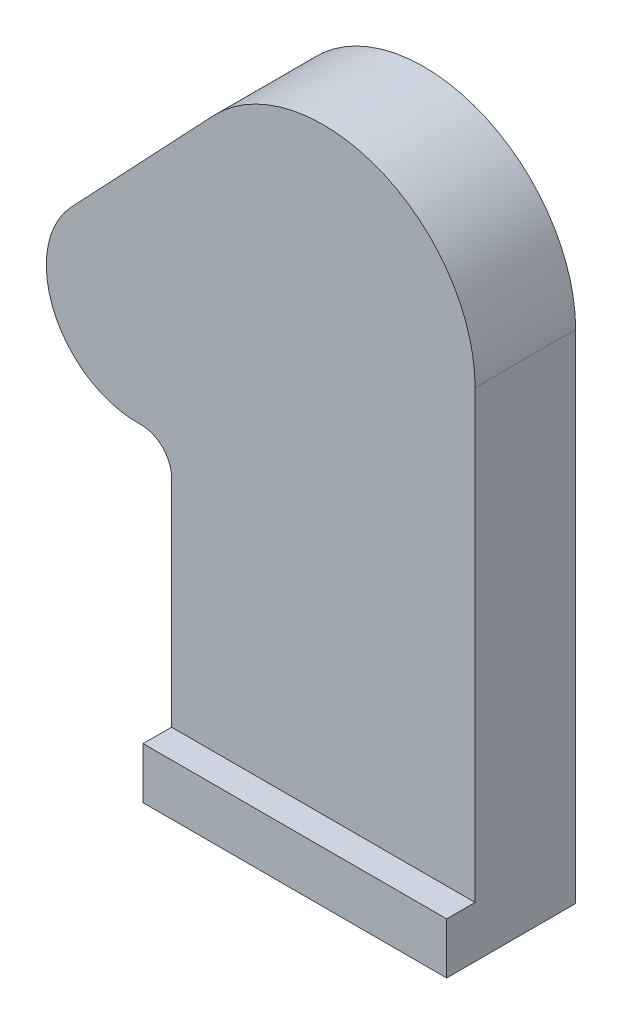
SolidWorks part; units mm, degrees
ref_plane "Plan de face" through (0, 0, 0) normal (0, 0, 1) x (1, 0, 0)
ref_plane "Plan de dessus" through (0, 0, 0) normal (0, 1, 0) x (1, 0, 0)
ref_plane "Plan de droite" through (0, 0, 0) normal (1, 0, 0) x (0, 0, -1)
sketch "Esquisse1" plane through (0, 0, 0) normal (0, 0, 1) x (1, 0, 0)
  line L0 (-80, -120.9687) -> (-80, -262)
  line L2 (80, 0) -> (80, -262)
  line L3 (-80, -262) -> (80, -262)
  line L5 (-132.8634, -24.0069) -> (-58.1056, 54.9886)
  arc A0 (-96.5, -104.9766) -> (-132.8634, -24.0069) centre (-98, -57) cw
  arc A1 (-58.1056, 54.9886) -> (80, 0) centre (0, 0) cw
  arc A2 (-80, -120.9687) -> (-96.5, -104.9766) centre (-96, -120.9687) ccw
  dimension "D2" = 16
  dimension "D5" = 48
  dimension "D3" = 80
  dimension "D1" = 160
  dimension "D4" = 262
  dimension "D6" = 18
  dimension "D7" = 205
extrude "Extrusion1" add sketch "Esquisse1" along normal blind 53
sketch "Esquisse3" plane through (0, 0, 53) normal (0, 0, 1) x (1, 0, 0)
  line L0 (80, -262) -> (80, 0) construction
  line L1 (-80, -262) -> (80, -262)
  line L2 (-80, -262) -> (-80, -235)
  line L3 (-80, -235) -> (80, -235)
  line L4 (80, -262) -> (80, -235)
  dimension "D1" = 27
extrude "Extrusion2" add sketch "Esquisse3" along normal blind 15
sketch "Esquisse4" plane through (0, 0, 53) normal (0, 0, 1) x (1, 0, 0)
  line L0 (-47, -98) -> (-47, -262)
  line L1 (-47, -262) -> (47, -262)
  line L2 (-80, -262) -> (80, -262) construction
  line L3 (47, -98) -> (7.1251, -58)
  line L4 (7.1251, -58) -> (7.1251, -42)
  line L5 (47, -98) -> (47, -262)
  line L6 (-47, -98) -> (-7.1251, -58)
  line L7 (-7.1251, -58) -> (-7.1251, -42)
  line L8 (80, -235) -> (80, 0) construction
  line L10 (-80, -120.9687) -> (-80, -235) construction
  arc A0 (7.1251, -42) -> (-7.1251, -42) centre (0, -42) ccw
  dimension "D9" = 16
  dimension "D1" = 33
  dimension "D2" = 33
  dimension "D3" = 164
  dimension "D4" = 204
  dimension "D5" = 164
  dimension "D6" = 204
  dimension "D7" = 14.2503
ref_plane "Plan1" through (0, -98, 0) normal (0, -1, 0) x (1, 0, 0)
sketch "Esquisse5" plane through (0, -98, 0) normal (0, -1, 0) x (1, 0, 0)
  line L0 (-46.3527, 68) -> (-41.9625, 26.2301)
  line L1 (-80, 68) -> (80, 68) construction
  line L2 (-41.9625, 26.2301) -> (0.3236, 10.8392)
  line L3 (0.3236, 10.8392) -> (42.6098, 26.2301)
  line L4 (42.6098, 26.2301) -> (47, 68)
  line L5 (47, 68) -> (-46.3527, 68)
  line L6 (-46.3527, 68) -> (-46.3527, 0) construction
  line L7 (47, 68) -> (47, 0) construction
  line L8 (-80, 0) -> (80, 0) construction
  line L9 (80, 68) -> (80, 0) construction
  line L14 (-80, 0) -> (80, 0)
  line L15 (80, 0) -> (80, 68)
  line L16 (80, 68) -> (-80, 68)
  line L17 (-80, 68) -> (-80, 0)
  line L18 (-80, 0) -> (80, 0)
  line L19 (80, 0) -> (80, 68)
  line L20 (80, 68) -> (-80, 68)
  line L21 (-80, 68) -> (-80, 0)
  dimension "D1" = 116
  dimension "D2" = 116
  dimension "D3" = 6
  dimension "D4" = 6
  dimension "D5" = 42
  dimension "D6" = 45
  dimension "D7" = 42
  dimension "D8" = 33
  dimension "D9" = 0
extrude "Enlèv. mat.-Extru.2" cut sketch "Esquisse5" along normal through all
sketch "Esquisse6" plane through (0, 0, 53) normal (0, 0, 1) x (1, 0, 0)
  circle A0 centre (0, 0) radius 49.9044
  circle A1 centre (-98, -57) radius 34.4005
